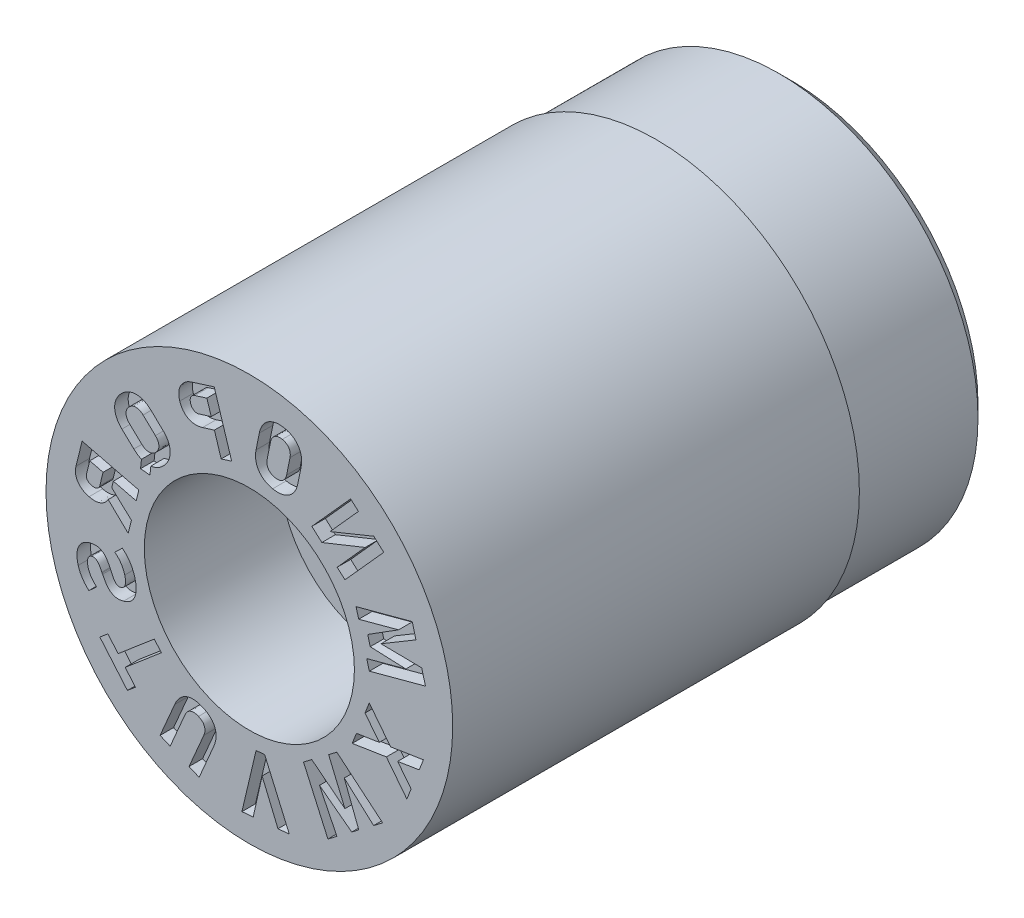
SolidWorks part; units mm, degrees
ref_plane "Front Plane" through (0, 0, 0) normal (0, 0, 1) x (1, 0, 0)
ref_plane "Top Plane" through (0, 0, 0) normal (0, 1, 0) x (1, 0, 0)
ref_plane "Right Plane" through (0, 0, 0) normal (1, 0, 0) x (0, 0, -1)
sketch "Sketch1" plane through (0, 0, 0) normal (1, 0, 0) x (0, 0, -1)
  line L2 (0, 3) -> (0, 1.55)
  line L3 (7.75, 3) -> (0, 3)
  line L4 (-3.7979, 0) -> (49996.2021, 0) construction
  line L8 (8, 0.8) -> (2, 0.8)
  line L9 (2, 1.55) -> (2, 0.8)
  line L10 (2, 1.55) -> (0, 1.55)
  line L12 (8, 0.8) -> (8, 2.75)
  line L16 (8, 2.75) -> (7.75, 3)
  dimension "D1" = 8
  dimension "D2" = 45
  dimension "D3" = 0.25
  dimension "D4" = 6
  dimension "D5" = 3.1
  dimension "D6" = 2
  dimension "D7" = 1.6
revolve "Revolve1" add sketch "Sketch1" angle 360 about L4
sketch "Sketch4" plane through (0, 0, 0) normal (1, 0, 0) x (0, 0, -1)
  line L0 (0, 0) -> (50000, 0) construction
  line L1 (8, -2.75) -> (8, 2.75) construction
  line L2 (6, 3.935) -> (8, 3.935)
  line L3 (6, 3.935) -> (6, 2.935)
  line L4 (6, 2.935) -> (8, 2.935)
  line L5 (8, 3.935) -> (8, 2.935)
  line L6 (7.75, 3) -> (0, 3) construction
  line L9 (0, 55) -> (0, -55) construction
  dimension "D1" = 1
  dimension "D2" = 0.065
  dimension "D3" = 6
revolve "Cut-Revolve1" cut sketch "Sketch4" angle 360 about L0
sketch "Sketch6" plane through (0, 0, 0) normal (0, 0, 1) x (1, 0, 0)
  line L0 (2.4581, 0.835) -> (2.4027, 1.0405)
  line L1 (2.4027, 1.0405) -> (1.5747, 0.8177)
  line L2 (1.5747, 0.8177) -> (1.613, 0.676)
  line L3 (1.613, 0.676) -> (2.201, 0.8342)
  line L5 (2.201, 0.8342) -> (1.7462, 0.5482)
  line L6 (1.7462, 0.5482) -> (1.7833, 0.4103)
  line L7 (1.7833, 0.4103) -> (2.3091, 0.3881)
  line L9 (2.3091, 0.3881) -> (1.7321, 0.2329)
  line L10 (1.7321, 0.2329) -> (1.7702, 0.0911)
  line L11 (1.7702, 0.0911) -> (2.5982, 0.3139)
  line L12 (2.5982, 0.3139) -> (2.543, 0.5195)
  line L13 (2.543, 0.5195) -> (1.9425, 0.5271)
  line L14 (1.9425, 0.5271) -> (2.4581, 0.835)
  line L15 (1.983, 1.7156) -> (1.8359, 1.8476)
  line L16 (1.8359, 1.8476) -> (1.1897, 1.5842)
  line L18 (1.1897, 1.5842) -> (1.6093, 2.0512)
  line L19 (1.6093, 2.0512) -> (1.4943, 2.1544)
  line L20 (1.4943, 2.1544) -> (0.922, 1.5172)
  line L21 (0.922, 1.5172) -> (1.0698, 1.3846)
  line L22 (1.0698, 1.3846) -> (1.7085, 1.6411)
  line L24 (1.7085, 1.6411) -> (1.2957, 1.1816)
  line L25 (1.2957, 1.1816) -> (1.4107, 1.0784)
  line L26 (1.4107, 1.0784) -> (1.983, 1.7156)
  line L27 (0.7155, 1.9574) -> (0.7638, 2.1967)
  line L28 (0.1471, 2.3212) -> (0.0988, 2.0819)
  line L29 (0.2628, 2.0447) -> (0.3128, 2.2921)
  line L30 (0.5998, 2.2341) -> (0.5498, 1.9867)
  line L31 (-0.5623, 2.177) -> (-0.7407, 2.121)
  line L32 (-0.8047, 2.3254) -> (-0.6264, 2.3813)
  line L33 (-0.6264, 2.3813) -> (-0.5623, 2.177)
  line L34 (-0.5185, 2.5788) -> (-0.8476, 2.4756)
  line L35 (-0.6901, 1.9732) -> (-0.5156, 2.0279)
  line L36 (-0.5156, 2.0279) -> (-0.4158, 1.7098)
  line L37 (-2.0061, 0.6305) -> (-1.6698, 0.5474)
  line L38 (-0.6732, 2.5304) -> (-0.6732, 2.5303)
  line L39 (-0.4158, 1.7098) -> (-0.261, 1.7582)
  line L40 (-0.261, 1.7582) -> (-0.5185, 2.5788)
  line L41 (-1.9361, -1.5386) -> (-2.087, -1.3609)
  line L42 (-1.591, 1.1183) -> (-1.6052, 0.9904)
  line L43 (-1.6052, 0.9904) -> (-1.4667, 0.9776)
  line L44 (-1.4667, 0.9776) -> (-1.4534, 1.0994)
  line L45 (-1.2744, 1.6459) -> (-1.4502, 1.8126)
  line L46 (-1.88, 1.3593) -> (-1.7042, 1.1927)
  line L47 (-1.5862, 1.3113) -> (-1.7679, 1.4836)
  line L48 (-1.5681, 1.6944) -> (-1.3863, 1.5221)
  line L49 (-2.1579, 0.6681) -> (-2.2064, 0.4721)
  line L50 (-2.403, 0.5206) -> (-2.3545, 0.7167)
  line L52 (-2.4672, 0.9117) -> (-2.5577, 0.5455)
  line L53 (-2.0298, 0.5349) -> (-2.0061, 0.6305)
  line L56 (-2.3545, 0.7167) -> (-2.1579, 0.6681)
  line L57 (-1.6698, 0.5474) -> (-1.6309, 0.7049)
  line L58 (-1.6309, 0.7049) -> (-2.4672, 0.9117)
  line L60 (-2.0824, 0.3576) -> (-1.7872, 0.0726)
  line L61 (-1.7872, 0.0726) -> (-1.74, 0.2634)
  line L62 (-1.74, 0.2634) -> (-2.0298, 0.5349)
  line L63 (-1.8754, -0.1606) -> (-1.9847, -0.2674)
  line L64 (-1.8941, -0.6718) -> (-1.8948, -0.672)
  line L65 (-2.034, -0.547) -> (-2.0391, -0.535)
  line L66 (-2.3529, -0.3313) -> (-2.3534, -0.3314)
  line L67 (-2.3669, -0.9476) -> (-2.2526, -0.8459)
  line L68 (-2.3264, -0.4903) -> (-2.326, -0.4901)
  line L69 (-1.8564, -0.8278) -> (-1.8553, -0.8276)
  line L71 (-1.8317, -1.6615) -> (-1.2978, -1.2078)
  line L72 (-1.2978, -1.2078) -> (-1.4022, -1.0849)
  line L73 (-1.4022, -1.0849) -> (-1.9361, -1.5386)
  line L74 (-2.2055, -1.4617) -> (-1.7992, -1.94)
  line L75 (-1.7992, -1.94) -> (-1.6806, -1.8393)
  line L76 (-1.6806, -1.8393) -> (-1.8317, -1.6615)
  line L77 (-2.087, -1.3609) -> (-2.2055, -1.4617)
  line L78 (-1.1011, -1.7701) -> (-1.3172, -2.2735)
  line L79 (-1.3172, -2.2735) -> (-1.1686, -2.3374)
  line L80 (-1.1686, -2.3374) -> (-0.9509, -1.8303)
  line L81 (-0.672, -1.95) -> (-0.8898, -2.4571)
  line L82 (-0.8898, -2.4571) -> (-0.7411, -2.521)
  line L83 (-0.7411, -2.521) -> (-0.525, -2.0176)
  line L84 (-0.1098, -2.6438) -> (0.057, -2.6289)
  line L85 (0.057, -2.6289) -> (0.1883, -2.0389)
  line L86 (0.1883, -2.0389) -> (0.4224, -2.5962)
  line L87 (0.4224, -2.5962) -> (0.5893, -2.5812)
  line L88 (0.5893, -2.5812) -> (0.2261, -1.7468)
  line L89 (0.2261, -1.7468) -> (0.0994, -1.7583)
  line L90 (0.0994, -1.7583) -> (-0.1098, -2.6438)
  line L91 (1.5108, -2.0937) -> (1.6147, -2.0153)
  line L92 (1.6147, -2.0153) -> (1.4003, -1.4594)
  line L93 (1.4003, -1.4594) -> (1.8336, -1.8498)
  line L94 (1.8336, -1.8498) -> (1.9664, -1.7494)
  line L95 (1.9664, -1.7494) -> (1.291, -1.1836)
  line L96 (1.291, -1.1836) -> (1.1696, -1.2754)
  line L97 (1.1696, -1.2754) -> (1.4096, -1.846)
  line L98 (1.4096, -1.846) -> (0.9208, -1.4633)
  line L99 (0.9208, -1.4633) -> (0.7991, -1.5553)
  line L100 (0.7991, -1.5553) -> (1.159, -2.3595)
  line L101 (1.159, -2.3595) -> (1.292, -2.2591)
  line L102 (1.292, -2.2591) -> (1.0345, -1.7357)
  line L103 (1.0345, -1.7357) -> (1.5108, -2.0937)
  line L105 (2.0215, -0.8787) -> (2.324, -1.2662)
  line L106 (2.324, -1.2662) -> (2.3866, -1.1066)
  line L107 (2.3866, -1.1066) -> (2.1881, -0.8524)
  line L109 (2.0836, -0.719) -> (1.7693, -0.3156)
  line L110 (1.7693, -0.3156) -> (1.7067, -0.4755)
  line L111 (1.7067, -0.4755) -> (1.9173, -0.7452)
  line L112 (2.1881, -0.8524) -> (2.5057, -0.8025)
  line L113 (2.5057, -0.8025) -> (2.5682, -0.6427)
  line L114 (2.5682, -0.6427) -> (2.0836, -0.719)
  line L115 (1.9173, -0.7452) -> (1.5802, -0.7983)
  line L116 (1.5802, -0.7983) -> (1.5176, -0.9581)
  line L117 (1.5176, -0.9581) -> (2.0215, -0.8787)
  spline S0 degree 3 poles (0.3442, 1.7083) (0.3591, 1.7054) (0.3814, 1.7021) (0.4109, 1.7003) (0.4324, 1.7005) (0.4534, 1.7017) (0.474, 1.7046) (0.4941, 1.7086) (0.5138, 1.714) (0.5328, 1.7208) (0.5511, 1.7288) (0.5686, 1.7379) (0.5854, 1.7481) (0.6014, 1.7597) (0.6165, 1.7726) (0.6308, 1.7866) (0.6444, 1.8015) (0.6569, 1.8178) (0.6686, 1.8349) (0.679, 1.8531) (0.6886, 1.872) (0.697, 1.892) (0.7069, 1.9202) (0.7124, 1.9424) (0.7155, 1.9574) knots 0 0 0 0 0.090342 0.133926 0.176326 0.218342 0.259221 0.300046 0.340423 0.380566 0.419947 0.459242 0.498156 0.537184 0.576555 0.616169 0.656337 0.697019 0.738169 0.779559 0.821755 0.864555 0.908487 1 1 1 1
  spline S1 degree 3 poles (0.7638, 2.1967) (0.7669, 2.2117) (0.7702, 2.2342) (0.772, 2.2641) (0.7721, 2.2858) (0.7707, 2.307) (0.7681, 2.3278) (0.7642, 2.3481) (0.7588, 2.3679) (0.7523, 2.387) (0.7443, 2.4055) (0.7354, 2.4232) (0.725, 2.4399) (0.7137, 2.456) (0.7012, 2.4712) (0.6875, 2.4856) (0.6725, 2.4991) (0.6565, 2.5118) (0.6395, 2.5233) (0.6216, 2.534) (0.6028, 2.5434) (0.583, 2.5518) (0.555, 2.5615) (0.5332, 2.5672) (0.5183, 2.5701) knots 0 0 0 0 0.091366 0.135283 0.17833 0.220352 0.261836 0.302954 0.343611 0.383783 0.423409 0.462933 0.501851 0.54077 0.579686 0.619123 0.659295 0.699738 0.740552 0.781648 0.823503 0.86596 0.909551 1 1 1 1
  spline S2 degree 3 poles (0.5183, 2.5701) (0.5034, 2.5729) (0.4813, 2.5767) (0.4517, 2.5782) (0.4302, 2.5782) (0.4092, 2.5768) (0.3887, 2.5739) (0.3686, 2.57) (0.3489, 2.5646) (0.3299, 2.5577) (0.3116, 2.5499) (0.2939, 2.5409) (0.2772, 2.5305) (0.2612, 2.5189) (0.2461, 2.5062) (0.2318, 2.4922) (0.2182, 2.4771) (0.2057, 2.4608) (0.194, 2.4437) (0.1835, 2.4256) (0.1739, 2.4066) (0.1655, 2.3867) (0.1557, 2.3584) (0.1502, 2.3363) (0.1471, 2.3212) knots 0 0 0 0 0.090258 0.13352 0.176247 0.217958 0.258842 0.299673 0.340056 0.380205 0.419831 0.458865 0.498067 0.537101 0.576167 0.615787 0.656289 0.696977 0.738132 0.779529 0.82173 0.864536 0.908475 1 1 1 1
  spline S3 degree 3 poles (0.0988, 2.0819) (0.0957, 2.0669) (0.0924, 2.0444) (0.0905, 2.0145) (0.0905, 1.9928) (0.0918, 1.9716) (0.0947, 1.9508) (0.0985, 1.9305) (0.104, 1.9107) (0.1105, 1.8915) (0.1183, 1.8732) (0.1274, 1.8556) (0.1375, 1.8387) (0.149, 1.8228) (0.1616, 1.8076) (0.1752, 1.7929) (0.1903, 1.7795) (0.2062, 1.7668) (0.2232, 1.7553) (0.2411, 1.7446) (0.2599, 1.7351) (0.2797, 1.7269) (0.3075, 1.7168) (0.3293, 1.7113) (0.3442, 1.7083) knots 0 0 0 0 0.091386 0.135312 0.178368 0.220399 0.262068 0.303195 0.34386 0.384041 0.423676 0.462718 0.501848 0.540592 0.579825 0.61941 0.659591 0.700042 0.740865 0.78197 0.823833 0.8663 0.909532 1 1 1 1
  spline S4 degree 3 poles (0.3763, 1.8675) (0.3628, 1.8703) (0.3433, 1.8765) (0.3197, 1.8892) (0.3044, 1.9007) (0.2911, 1.9139) (0.2799, 1.9288) (0.271, 1.9453) (0.2645, 1.9633) (0.2601, 1.9823) (0.258, 2.0098) (0.2598, 2.0308) (0.2628, 2.0447) knots 0 0 0 0 0.174711 0.257204 0.337202 0.416169 0.494051 0.572475 0.652529 0.735233 0.819588 1 1 1 1
  spline S5 degree 3 poles (0.3128, 2.2921) (0.3159, 2.3059) (0.3217, 2.3262) (0.3345, 2.3505) (0.3459, 2.3664) (0.3587, 2.3805) (0.3736, 2.392) (0.3896, 2.4016) (0.4071, 2.4085) (0.4257, 2.413) (0.4523, 2.4159) (0.4727, 2.4137) (0.4862, 2.4109) knots 0 0 0 0 0.180046 0.264695 0.346531 0.426791 0.505247 0.583508 0.66249 0.742821 0.82494 1 1 1 1
  spline S6 degree 3 poles (0.4862, 2.4109) (0.4998, 2.4083) (0.5194, 2.4021) (0.543, 2.3893) (0.5584, 2.3779) (0.5717, 2.3646) (0.583, 2.3498) (0.5917, 2.3333) (0.5984, 2.3154) (0.6023, 2.2963) (0.6051, 2.269) (0.6025, 2.248) (0.5998, 2.2341) knots 0 0 0 0 0.175547 0.258039 0.338755 0.417721 0.494591 0.573477 0.65353 0.735806 0.819855 1 1 1 1
  spline S7 degree 3 poles (0.5498, 1.9867) (0.5472, 1.9727) (0.5407, 1.9527) (0.5283, 1.9282) (0.5169, 1.9123) (0.504, 1.8981) (0.4892, 1.8866) (0.4733, 1.877) (0.4558, 1.87) (0.4371, 1.8656) (0.4104, 1.8626) (0.3899, 1.8649) (0.3763, 1.8675) knots 0 0 0 0 0.179817 0.264259 0.346675 0.426797 0.505118 0.582212 0.661578 0.742363 0.824342 1 1 1 1
  spline S8 degree 3 poles (-0.7407, 2.121) (-0.7495, 2.1184) (-0.7629, 2.1156) (-0.7807, 2.116) (-0.7935, 2.1182) (-0.8058, 2.1219) (-0.8172, 2.1278) (-0.8282, 2.1348) (-0.838, 2.1439) (-0.847, 2.1542) (-0.8576, 2.1703) (-0.8633, 2.1839) (-0.8663, 2.1934) knots 0 0 0 0 0.169348 0.249424 0.327812 0.406817 0.485323 0.564065 0.64578 0.730166 0.816292 1 1 1 1
  spline S9 degree 3 poles (-0.8663, 2.1934) (-0.8692, 2.2031) (-0.8725, 2.2175) (-0.8731, 2.2369) (-0.8717, 2.2506) (-0.869, 2.2638) (-0.8642, 2.2759) (-0.8581, 2.2872) (-0.8502, 2.2974) (-0.8409, 2.3064) (-0.8264, 2.3172) (-0.8135, 2.3224) (-0.8047, 2.3254) knots 0 0 0 0 0.184201 0.269928 0.354147 0.435879 0.514485 0.591971 0.670446 0.749568 0.82874 1 1 1 1
  spline S10 degree 3 poles (-0.8476, 2.4756) (-0.8718, 2.4681) (-0.9064, 2.4533) (-0.9471, 2.426) (-0.9732, 2.4025) (-0.9955, 2.3766) (-1.0138, 2.3483) (-1.0274, 2.3176) (-1.0367, 2.285) (-1.0415, 2.2509) (-1.0414, 2.2028) (-1.0341, 2.1667) (-1.0267, 2.143) knots 0 0 0 0 0.178997 0.263115 0.345347 0.425848 0.503868 0.582284 0.661421 0.742522 0.824532 1 1 1 1
  spline S11 degree 3 poles (-1.0267, 2.143) (-1.0191, 2.1194) (-1.0048, 2.0853) (-0.977, 2.0461) (-0.9537, 2.0207) (-0.9274, 1.9995) (-0.8988, 1.9823) (-0.8678, 1.9694) (-0.8347, 1.9612) (-0.8, 1.9569) (-0.751, 1.958) (-0.7142, 1.9655) (-0.6901, 1.9732) knots 0 0 0 0 0.17572 0.258308 0.339189 0.418258 0.496075 0.574428 0.654646 0.736536 0.820715 1 1 1 1
  spline S12 degree 3 poles (-1.2605, 1.2025) (-1.2501, 1.2134) (-1.2356, 1.2304) (-1.2186, 1.2544) (-1.2072, 1.2723) (-1.1974, 1.2908) (-1.1888, 1.3096) (-1.1819, 1.3288) (-1.176, 1.3482) (-1.1717, 1.3677) (-1.1687, 1.3873) (-1.167, 1.4069) (-1.1672, 1.4264) (-1.1683, 1.4459) (-1.1713, 1.4653) (-1.1752, 1.4848) (-1.1808, 1.5041) (-1.1879, 1.5231) (-1.1961, 1.5419) (-1.2056, 1.5604) (-1.217, 1.5781) (-1.2291, 1.5959) (-1.2478, 1.619) (-1.2633, 1.6355) (-1.2744, 1.6459) knots 0 0 0 0 0.090322 0.133749 0.176265 0.21812 0.259211 0.300051 0.340645 0.380719 0.420125 0.459401 0.49838 0.537304 0.576384 0.616106 0.656424 0.697131 0.737967 0.779552 0.821614 0.864434 0.908417 1 1 1 1
  spline S13 degree 3 poles (-1.4502, 1.8126) (-1.4612, 1.8232) (-1.4784, 1.8379) (-1.5027, 1.8551) (-1.5208, 1.8666) (-1.5394, 1.8767) (-1.5583, 1.8853) (-1.5775, 1.8927) (-1.597, 1.8987) (-1.6166, 1.9032) (-1.6362, 1.9065) (-1.6558, 1.9079) (-1.6754, 1.9084) (-1.6948, 1.907) (-1.7143, 1.9047) (-1.7337, 1.9006) (-1.7529, 1.8951) (-1.772, 1.8883) (-1.7907, 1.88) (-1.809, 1.8706) (-1.8269, 1.8598) (-1.8443, 1.8476) (-1.8672, 1.8292) (-1.8835, 1.814) (-1.8938, 1.803) knots 0 0 0 0 0.091545 0.135456 0.178453 0.220484 0.26204 0.303154 0.34386 0.38436 0.423832 0.463101 0.502117 0.541033 0.580049 0.619765 0.659655 0.700253 0.741081 0.782196 0.823915 0.866429 0.909914 1 1 1 1
  spline S14 degree 3 poles (-1.8938, 1.803) (-1.9041, 1.7921) (-1.9186, 1.7751) (-1.9356, 1.7511) (-1.947, 1.7331) (-1.9569, 1.7147) (-1.9653, 1.6959) (-1.9726, 1.6768) (-1.9784, 1.6574) (-1.9828, 1.6378) (-1.9857, 1.6183) (-1.9873, 1.5987) (-1.9876, 1.5792) (-1.986, 1.5597) (-1.9835, 1.5401) (-1.9792, 1.5207) (-1.9736, 1.5014) (-1.9665, 1.4823) (-1.9584, 1.4634) (-1.9486, 1.4451) (-1.9377, 1.427) (-1.9253, 1.4094) (-1.9066, 1.3863) (-1.8911, 1.3698) (-1.88, 1.3593) knots 0 0 0 0 0.090272 0.133676 0.176168 0.218 0.259069 0.299705 0.340277 0.380329 0.420056 0.458963 0.497942 0.537199 0.576228 0.615983 0.656278 0.696963 0.738104 0.779349 0.821528 0.864509 0.908467 1 1 1 1
  spline S15 degree 3 poles (-1.7042, 1.1927) (-1.6932, 1.1821) (-1.676, 1.1674) (-1.6518, 1.1502) (-1.6335, 1.1389) (-1.615, 1.1287) (-1.6007, 1.1222) (-1.5927, 1.119) (-1.591, 1.1183) knots 0 0 0 0 0.091556 0.135474 0.178274 0.22031 0.261872 0.272584 0.272584 0.272584 0.272584
  spline S16 degree 3 poles (-1.3774, 1.3133) (-1.3868, 1.3032) (-1.4024, 1.2902) (-1.4255, 1.2769) (-1.4433, 1.2702) (-1.4615, 1.266) (-1.4799, 1.2644) (-1.4985, 1.2658) (-1.517, 1.2697) (-1.5352, 1.2764) (-1.5597, 1.2884) (-1.5757, 1.3019) (-1.5862, 1.3113) knots 0 0 0 0 0.175423 0.257726 0.338312 0.416953 0.495218 0.57331 0.653557 0.736033 0.820131 1 1 1 1
  spline S17 degree 3 poles (-1.7679, 1.4836) (-1.7781, 1.4934) (-1.7921, 1.509) (-1.8056, 1.5326) (-1.8132, 1.5505) (-1.8181, 1.5688) (-1.8204, 1.5872) (-1.8197, 1.6057) (-1.8165, 1.6241) (-1.8106, 1.6421) (-1.7988, 1.666) (-1.7862, 1.6821) (-1.7768, 1.6921) knots 0 0 0 0 0.180354 0.264618 0.346828 0.426724 0.505096 0.582839 0.661602 0.742235 0.824265 1 1 1 1
  spline S18 degree 3 poles (-1.7768, 1.6921) (-1.7674, 1.7021) (-1.752, 1.7153) (-1.7289, 1.7285) (-1.7111, 1.7352) (-1.6929, 1.7394) (-1.6745, 1.741) (-1.656, 1.7398) (-1.6374, 1.7361) (-1.6192, 1.7294) (-1.5948, 1.717) (-1.5783, 1.7042) (-1.5681, 1.6944) knots 0 0 0 0 0.174779 0.257073 0.337649 0.41628 0.494535 0.572528 0.652576 0.735041 0.819501 1 1 1 1
  spline S19 degree 3 poles (-1.3863, 1.5221) (-1.376, 1.5124) (-1.3625, 1.4965) (-1.3486, 1.4731) (-1.3411, 1.4551) (-1.3361, 1.4368) (-1.3341, 1.4182) (-1.3347, 1.3998) (-1.3379, 1.3814) (-1.3438, 1.3633) (-1.3557, 1.3395) (-1.3679, 1.3233) (-1.3774, 1.3133) knots 0 0 0 0 0.179895 0.264486 0.346683 0.427297 0.505611 0.583343 0.662096 0.742716 0.824735 1 1 1 1
  spline S20 degree 3 poles (-2.2064, 0.4721) (-2.2084, 0.4644) (-2.2124, 0.4533) (-2.221, 0.4405) (-2.2288, 0.4322) (-2.2377, 0.4251) (-2.2476, 0.4194) (-2.2587, 0.4151) (-2.2706, 0.4122) (-2.2834, 0.4106) (-2.3017, 0.4105) (-2.3155, 0.4126) (-2.3248, 0.4146) knots 0 0 0 0 0.160421 0.236858 0.313185 0.389733 0.467133 0.545429 0.629531 0.716485 0.806787 1 1 1 1
  spline S21 degree 3 poles (-2.3248, 0.4146) (-2.334, 0.417) (-2.3473, 0.4215) (-2.3635, 0.4298) (-2.374, 0.4371) (-2.3832, 0.4453) (-2.3911, 0.4542) (-2.3972, 0.4639) (-2.4017, 0.4744) (-2.4048, 0.4853) (-2.4063, 0.5009) (-2.405, 0.5128) (-2.403, 0.5206) knots 0 0 0 0 0.192838 0.281594 0.368638 0.451586 0.530264 0.608207 0.683983 0.760173 0.836977 1 1 1 1
  spline S22 degree 3 poles (-2.5577, 0.5455) (-2.5631, 0.5238) (-2.5677, 0.4906) (-2.5643, 0.4471) (-2.5575, 0.4164) (-2.5465, 0.3874) (-2.5312, 0.3605) (-2.5122, 0.3356) (-2.4892, 0.3132) (-2.4628, 0.2932) (-2.4222, 0.2701) (-2.3883, 0.2585) (-2.3649, 0.2526) knots 0 0 0 0 0.170629 0.251442 0.330525 0.408845 0.486561 0.564835 0.646024 0.729751 0.815948 1 1 1 1
  spline S23 degree 3 poles (-2.3649, 0.2526) (-2.3413, 0.2467) (-2.3058, 0.2414) (-2.2592, 0.243) (-2.2266, 0.2483) (-2.1959, 0.2575) (-2.1674, 0.2705) (-2.1414, 0.2876) (-2.1182, 0.3083) (-2.098, 0.3316) (-2.0872, 0.3489) (-2.0824, 0.3576) knots 0 0 0 0 0.184714 0.270646 0.354048 0.43507 0.513594 0.591324 0.670175 0.749465 0.824818 0.824818 0.824818 0.824818
  spline S24 degree 3 poles (-1.689, -0.4443) (-1.6941, -0.4247) (-1.7038, -0.396) (-1.719, -0.3586) (-1.7321, -0.3317) (-1.7464, -0.3057) (-1.7615, -0.2807) (-1.7781, -0.257) (-1.7957, -0.2346) (-1.8143, -0.2137) (-1.8398, -0.1878) (-1.861, -0.171) (-1.8754, -0.1606) knots 0 0 0 0 0.175598 0.262483 0.349341 0.434959 0.519565 0.602929 0.685299 0.766451 0.845567 1 1 1 1
  spline S25 degree 3 poles (-1.9847, -0.2674) (-1.9673, -0.28) (-1.9426, -0.3013) (-1.914, -0.3343) (-1.894, -0.3615) (-1.876, -0.3903) (-1.8557, -0.4308) (-1.8439, -0.4626) (-1.8383, -0.4846) knots 0 0 0 0 0.241135 0.364899 0.491079 0.619192 0.746135 1 1 1 1
  spline S26 degree 3 poles (-1.8383, -0.4846) (-1.8352, -0.4966) (-1.8309, -0.5143) (-1.8276, -0.5376) (-1.8264, -0.5538) (-1.8263, -0.5691) (-1.8269, -0.5836) (-1.829, -0.5972) (-1.8321, -0.61) (-1.8362, -0.6218) (-1.8415, -0.6323) (-1.8476, -0.6419) (-1.8547, -0.6504) (-1.8632, -0.6574) (-1.8759, -0.6656) (-1.8866, -0.6699) (-1.8941, -0.6718) knots 0 0 0 0 0.170512 0.249193 0.322989 0.392929 0.458909 0.521578 0.581623 0.63844 0.692199 0.743422 0.793582 0.843228 0.893745 1 1 1 1
  spline S27 degree 3 poles (-1.8948, -0.672) (-1.9047, -0.6749) (-1.9199, -0.6766) (-1.9394, -0.6732) (-1.9525, -0.6677) (-1.9642, -0.6598) (-1.9751, -0.6502) (-1.985, -0.6389) (-1.9942, -0.6257) (-2.003, -0.6105) (-2.0158, -0.5863) (-2.0251, -0.5669) (-2.0311, -0.5531) knots 0 0 0 0 0.155056 0.225229 0.294567 0.36504 0.436189 0.511218 0.59032 0.676994 0.774232 1 1 1 1
  spline S28 degree 3 poles (-2.0311, -0.5531) (-2.0317, -0.5521) (-2.0328, -0.5502) (-2.0331, -0.5479) (-2.034, -0.547) knots 0 0 0 0 0.497856 1 1 1 1
  spline S29 degree 3 poles (-2.0391, -0.535) (-2.0503, -0.5108) (-2.0662, -0.4757) (-2.091, -0.4334) (-2.1081, -0.4061) (-2.1273, -0.3824) (-2.1492, -0.3619) (-2.1748, -0.3451) (-2.1981, -0.3333) (-2.2183, -0.3259) (-2.2347, -0.3222) (-2.2521, -0.3199) (-2.2704, -0.3189) (-2.2897, -0.3199) (-2.3175, -0.3228) (-2.3386, -0.3274) (-2.3529, -0.3313) knots 0 0 0 0 0.190838 0.273711 0.349181 0.420041 0.490646 0.562537 0.637383 0.676094 0.715571 0.757136 0.8008 0.846438 0.894726 1 1 1 1
  spline S30 degree 3 poles (-2.3534, -0.3314) (-2.3664, -0.3348) (-2.3851, -0.3411) (-2.4089, -0.3516) (-2.4255, -0.3601) (-2.4409, -0.3696) (-2.4553, -0.3803) (-2.4688, -0.3917) (-2.4812, -0.4039) (-2.4924, -0.4171) (-2.5026, -0.4311) (-2.5117, -0.446) (-2.5196, -0.4617) (-2.5264, -0.478) (-2.5322, -0.4952) (-2.5366, -0.5132) (-2.5401, -0.5319) (-2.5423, -0.5514) (-2.5435, -0.5715) (-2.5432, -0.5922) (-2.542, -0.6135) (-2.5395, -0.6356) (-2.5346, -0.6663) (-2.5293, -0.6895) (-2.5251, -0.705) knots 0 0 0 0 0.085943 0.127134 0.16662 0.205702 0.243866 0.281663 0.318926 0.355994 0.39299 0.430134 0.467849 0.505638 0.544226 0.584072 0.62457 0.666717 0.709849 0.753925 0.799786 0.847384 0.896494 1 1 1 1
  spline S31 degree 3 poles (-2.5251, -0.705) (-2.5213, -0.7201) (-2.5136, -0.7423) (-2.5014, -0.7714) (-2.4871, -0.8006) (-2.4661, -0.8361) (-2.4271, -0.8899) (-2.3922, -0.9259) (-2.3669, -0.9476) knots 0 0 0 0 0.158506 0.239681 0.322226 0.490467 0.659592 1 1 1 1
  spline S32 degree 3 poles (-2.2526, -0.8459) (-2.2676, -0.8332) (-2.2888, -0.8128) (-2.3142, -0.7833) (-2.3311, -0.7603) (-2.3459, -0.7368) (-2.3625, -0.7057) (-2.3714, -0.6812) (-2.376, -0.6649) knots 0 0 0 0 0.265836 0.395704 0.524969 0.65039 0.771085 1 1 1 1
  spline S33 degree 3 poles (-2.376, -0.6649) (-2.379, -0.6536) (-2.3829, -0.637) (-2.3861, -0.6151) (-2.3874, -0.5999) (-2.3877, -0.5856) (-2.3869, -0.572) (-2.3853, -0.5594) (-2.3825, -0.5475) (-2.3788, -0.5366) (-2.3741, -0.5268) (-2.3686, -0.5179) (-2.3619, -0.5103) (-2.3545, -0.5034) (-2.3429, -0.4961) (-2.3333, -0.4919) (-2.3264, -0.4903) knots 0 0 0 0 0.172983 0.252068 0.326646 0.397799 0.463929 0.527345 0.586625 0.643595 0.697029 0.747645 0.797097 0.846572 0.89588 1 1 1 1
  spline S34 degree 3 poles (-2.326, -0.4901) (-2.3151, -0.487) (-2.2986, -0.4851) (-2.2774, -0.4888) (-2.2635, -0.495) (-2.2509, -0.5034) (-2.2393, -0.5132) (-2.2287, -0.5247) (-2.2193, -0.5382) (-2.2097, -0.5539) (-2.1949, -0.5801) (-2.1839, -0.6017) (-2.1763, -0.6171) knots 0 0 0 0 0.157038 0.226588 0.296143 0.366113 0.435857 0.507254 0.581383 0.664104 0.762196 1 1 1 1
  spline S35 degree 3 poles (-2.1763, -0.6171) (-2.1754, -0.6184) (-2.1745, -0.6216) (-2.1729, -0.6244) (-2.1721, -0.6258) knots 0 0 0 0 0.492331 1 1 1 1
  spline S36 degree 3 poles (-2.1721, -0.6258) (-2.1712, -0.6279) (-2.1692, -0.6321) (-2.1667, -0.6359) (-2.1657, -0.6381) knots 0 0 0 0 0.494321 1 1 1 1
  spline S37 degree 3 poles (-2.1657, -0.6381) (-2.1545, -0.6611) (-2.1374, -0.6938) (-2.1119, -0.7337) (-2.094, -0.7594) (-2.0743, -0.7818) (-2.0518, -0.8006) (-2.0267, -0.8165) (-2.0036, -0.8269) (-1.9839, -0.8335) (-1.968, -0.8369) (-1.9514, -0.8388) (-1.934, -0.8394) (-1.9156, -0.8389) (-1.8896, -0.8354) (-1.8698, -0.8314) (-1.8564, -0.8278) knots 0 0 0 0 0.189877 0.273554 0.35015 0.422279 0.494078 0.566932 0.642065 0.681025 0.720888 0.762041 0.805066 0.85022 0.897772 1 1 1 1
  spline S38 degree 3 poles (-1.8553, -0.8276) (-1.8427, -0.824) (-1.824, -0.8181) (-1.8006, -0.8074) (-1.7842, -0.7989) (-1.7691, -0.789) (-1.7548, -0.7784) (-1.7417, -0.7667) (-1.7295, -0.7542) (-1.7185, -0.7406) (-1.7084, -0.7263) (-1.6996, -0.7111) (-1.6919, -0.695) (-1.6853, -0.6782) (-1.68, -0.6605) (-1.6757, -0.642) (-1.6725, -0.6227) (-1.6706, -0.6026) (-1.6696, -0.5819) (-1.6701, -0.5606) (-1.6713, -0.5385) (-1.6741, -0.5159) (-1.6792, -0.4842) (-1.6847, -0.4603) (-1.689, -0.4443) knots 0 0 0 0 0.083555 0.123757 0.16267 0.200489 0.238156 0.275196 0.312127 0.348926 0.385707 0.422867 0.460461 0.498401 0.537441 0.577527 0.618827 0.661275 0.705243 0.750169 0.796542 0.844974 0.894907 1 1 1 1
  spline S39 degree 3 poles (-0.6877, -1.6002) (-0.7023, -1.5939) (-0.7244, -1.5857) (-0.7541, -1.577) (-0.7756, -1.5724) (-0.7968, -1.569) (-0.8176, -1.5672) (-0.838, -1.5665) (-0.858, -1.5677) (-0.8776, -1.5699) (-0.8967, -1.5738) (-0.9152, -1.579) (-0.9333, -1.5854) (-0.9507, -1.5934) (-0.9675, -1.6029) (-0.9839, -1.6135) (-0.9997, -1.6258) (-1.0147, -1.6394) (-1.0293, -1.6541) (-1.0429, -1.6703) (-1.0562, -1.6876) (-1.0684, -1.7064) (-1.0843, -1.7335) (-1.0947, -1.7552) (-1.1011, -1.7701) knots 0 0 0 0 0.094052 0.138857 0.182257 0.224033 0.265306 0.305274 0.344638 0.383308 0.421558 0.459329 0.496982 0.534475 0.572175 0.610708 0.649838 0.689831 0.730178 0.771779 0.814727 0.858617 0.904208 1 1 1 1
  spline S40 degree 3 poles (-0.9509, -1.8303) (-0.9462, -1.8196) (-0.9386, -1.8043) (-0.9262, -1.7859) (-0.9163, -1.7738) (-0.9057, -1.7632) (-0.8944, -1.7542) (-0.8823, -1.7467) (-0.8696, -1.7403) (-0.8562, -1.7356) (-0.8423, -1.7326) (-0.8281, -1.7309) (-0.8134, -1.7312) (-0.7983, -1.7326) (-0.777, -1.737) (-0.7613, -1.7429) (-0.7508, -1.7472) knots 0 0 0 0 0.141764 0.207322 0.270383 0.33084 0.38936 0.446675 0.504025 0.561639 0.618711 0.676593 0.735932 0.796939 0.86125 1 1 1 1
  spline S41 degree 3 poles (-0.7508, -1.7472) (-0.7401, -1.7515) (-0.7253, -1.7594) (-0.7072, -1.7716) (-0.6956, -1.7817) (-0.6852, -1.7922) (-0.6766, -1.8038) (-0.669, -1.8159) (-0.6634, -1.8289) (-0.659, -1.8424) (-0.6561, -1.8565) (-0.6547, -1.871) (-0.6553, -1.886) (-0.657, -1.9014) (-0.6618, -1.9232) (-0.6674, -1.9393) (-0.672, -1.95) knots 0 0 0 0 0.138812 0.203284 0.264542 0.324055 0.382496 0.439744 0.496882 0.554235 0.611832 0.670363 0.730476 0.793336 0.858574 1 1 1 1
  spline S42 degree 3 poles (-0.525, -2.0176) (-0.5186, -2.0026) (-0.51, -1.9802) (-0.5015, -1.95) (-0.4963, -1.9281) (-0.4928, -1.9066) (-0.4905, -1.8856) (-0.4899, -1.8649) (-0.4905, -1.8445) (-0.4928, -1.8247) (-0.4962, -1.8053) (-0.5011, -1.7866) (-0.5075, -1.7685) (-0.5152, -1.7509) (-0.524, -1.7337) (-0.5346, -1.7173) (-0.5465, -1.7015) (-0.5597, -1.6863) (-0.574, -1.6716) (-0.5898, -1.6579) (-0.6067, -1.6447) (-0.6252, -1.6327) (-0.6516, -1.6166) (-0.673, -1.6066) (-0.6877, -1.6002) knots 0 0 0 0 0.095757 0.140963 0.185152 0.227892 0.269135 0.309772 0.349751 0.38905 0.427322 0.465359 0.503094 0.540432 0.578341 0.616539 0.655339 0.694949 0.734873 0.775997 0.818145 0.861218 0.905887 1 1 1 1
  spline S43 degree 3 poles (-1.4534, 1.0994) (-1.449, 1.0999) (-1.4381, 1.1014) (-1.4207, 1.1051) (-1.4014, 1.1105) (-1.3823, 1.1174) (-1.3635, 1.1254) (-1.3452, 1.1348) (-1.3275, 1.1458) (-1.3099, 1.1578) (-1.287, 1.1763) (-1.2707, 1.1915) (-1.2605, 1.2025) knots 0.55339 0.55339 0.55339 0.55339 0.579786 0.619506 0.659744 0.700347 0.741058 0.782178 0.823594 0.866412 0.909903 1 1 1 1
extrude "Cut-Extrude1" cut sketch "Sketch6" against normal blind 0.2 contours L44 S43 S12 L45 S13 S14 L46 S15 L42 L43 L48 S19 S16 L47 S17 S18 | S10 S11 L35 L36 L39 L40 L34 S8 S9 L32 L33 L31 | L28 S3 S0 L27 S1 S2 L30 S7 S4 L29 S5 S6 | L25 L26 L15 L16 L18 L19 L20 L21 L22 L24 | L13 L14 L0 L1 L2 L3 L5 L6 L7 L9 L10 L11 L12 | L116 L117 L105 L106 L107 L112 L113 L114 L109 L110 L111 L115 | L102 L103 L91 L92 L93 L94 L95 L96 L97 L98 L99 L100 L101 | L89 L90 L84 L85 L86 L87 L88 | L83 S42 S39 L78 L79 L80 S40 S41 L81 L82 | L41 L77 L74 L75 L76 L71 L72 L73 | L69 S38 S24 L63 S25 S26 L64 S27 S28 L65 S29 L66 S30 S31 L67 S32 S33 L68 S34 S35 S36 S37 | S22 S23 L60 L61 L62 L53 L37 L57 L58 L52 S20 S21 L50 L56 L49
